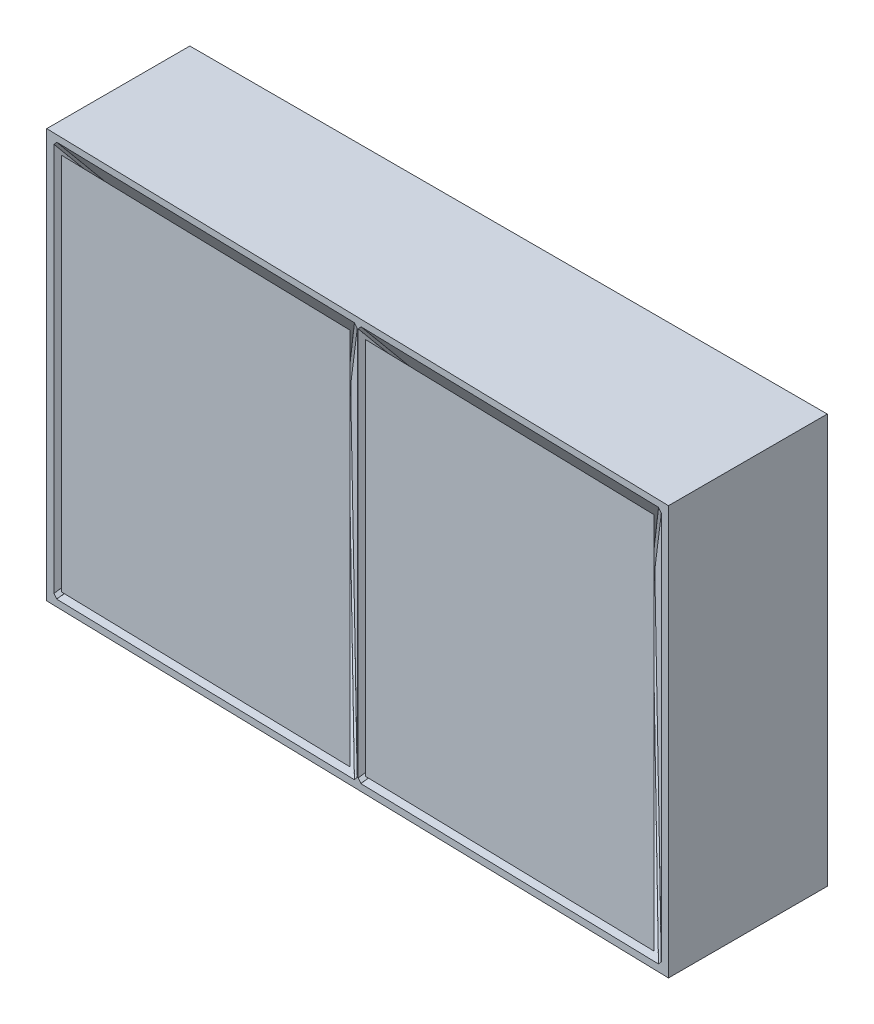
SolidWorks part; units mm, degrees
ref_plane "Ebene vorne" through (0, 0, 0) normal (0, 0, 1) x (1, 0, 0)
ref_plane "Ebene oben" through (0, 0, 0) normal (0, 1, 0) x (1, 0, 0)
ref_plane "Ebene rechts" through (0, 0, 0) normal (1, 0, 0) x (0, 0, -1)
sketch "Skizze1" plane through (0, 0, 0) normal (0, 0, 1) x (1, 0, 0)
  line L0 (1220.3266, 1032.8596) -> (1220.3266, -133.7284) construction
  line L1 (-639.9725, -153.7062) -> (1240.3266, -153.7062)
  line L2 (-639.9725, -153.7062) -> (-639.9725, 1052.8596)
  line L3 (-639.9725, 1052.8596) -> (1240.3266, 1052.8596)
  line L4 (1240.3266, -153.7062) -> (1240.3266, 1052.8596)
  line L5 (-619.48, 1032.8596) -> (1220.3266, 1032.8596) construction
  line L6 (-609.3986, -133.7062) -> (290.3285, -133.7062) construction
  line L7 (-619.9725, 1032.8596) -> (-619.9725, -133.7284) construction
  dimension "D1" = 20
  dimension "D2" = 20
  dimension "D3" = 20
  dimension "D4" = 20
extrude "Aufsatz-Linear austragen1" add sketch "Skizze1" along normal up to surface (422.0929 mm away)
other "Formnest3"
other "Unterbau_PU_Schaum<1>@3er-Wanne_3er-Wanne/Trichter_3er_Stripper<2>@Unterbau_PU_Schaum/Trichter_Schweißnaht<4>@Trichter_3er_Stripper"
other "Unterbau_PU_Schaum<1>@3er-Wanne_3er-Wanne/Trichter_3er_Stripper<2>@Unterbau_PU_Schaum/Trichter_Ablauf_3er<1>@Trichter_3er_Stripper"
other "Unterbau_PU_Schaum<1>@3er-Wanne_3er-Wanne/Trichter_3er_Stripper<2>@Unterbau_PU_Schaum/Trichter_Schweißnaht<3>@Trichter_3er_Stripper"
other "Unterbau_PU_Schaum<1>@3er-Wanne_3er-Wanne/Trichter_3er_Stripper<2>@Unterbau_PU_Schaum/Trichter_Seitenteil<5>@Trichter_3er_Stripper"
other "Unterbau_PU_Schaum<1>@3er-Wanne_3er-Wanne/Trichter_3er_Stripper<2>@Unterbau_PU_Schaum/Trichter_Schweißnaht<2>@Trichter_3er_Stripper"
other "Unterbau_PU_Schaum<1>@3er-Wanne_3er-Wanne/Trichter_3er_Stripper<2>@Unterbau_PU_Schaum/Trichter_Schweißnaht<1>@Trichter_3er_Stripper"
other "Unterbau_PU_Schaum<1>@3er-Wanne_3er-Wanne/Trichter_3er_Stripper<2>@Unterbau_PU_Schaum/Trichter_Seitenteil<3>@Trichter_3er_Stripper"
other "Unterbau_PU_Schaum<1>@3er-Wanne_3er-Wanne/Trichter_3er_Stripper<2>@Unterbau_PU_Schaum/Trichter_Seitenteil_breit<2>@Trichter_3er_Stripper"
other "Unterbau_PU_Schaum<1>@3er-Wanne_3er-Wanne/Trichter_3er_Stripper<2>@Unterbau_PU_Schaum/Trichter_Seitenteil_breit<1>@Trichter_3er_Stripper"
other "Unterbau_PU_Schaum<1>@3er-Wanne_3er-Wanne/Trichter_3er_Stripper<1>@Unterbau_PU_Schaum/Trichter_Ablauf_3er<1>@Trichter_3er_Stripper"
other "Unterbau_PU_Schaum<1>@3er-Wanne_3er-Wanne/Trichter_3er_Stripper<1>@Unterbau_PU_Schaum/Trichter_Schweißnaht<4>@Trichter_3er_Stripper"
other "Unterbau_PU_Schaum<1>@3er-Wanne_3er-Wanne/Trichter_3er_Stripper<1>@Unterbau_PU_Schaum/Trichter_Schweißnaht<3>@Trichter_3er_Stripper"
other "Unterbau_PU_Schaum<1>@3er-Wanne_3er-Wanne/Trichter_3er_Stripper<1>@Unterbau_PU_Schaum/Trichter_Schweißnaht<2>@Trichter_3er_Stripper"
other "Unterbau_PU_Schaum<1>@3er-Wanne_3er-Wanne/Trichter_3er_Stripper<1>@Unterbau_PU_Schaum/Trichter_Schweißnaht<1>@Trichter_3er_Stripper"
other "Unterbau_PU_Schaum<1>@3er-Wanne_3er-Wanne/Trichter_3er_Stripper<1>@Unterbau_PU_Schaum/Trichter_Seitenteil<5>@Trichter_3er_Stripper"
other "Unterbau_PU_Schaum<1>@3er-Wanne_3er-Wanne/Trichter_3er_Stripper<1>@Unterbau_PU_Schaum/Trichter_Seitenteil_breit<2>@Trichter_3er_Stripper"
other "Unterbau_PU_Schaum<1>@3er-Wanne_3er-Wanne/Trichter_3er_Stripper<1>@Unterbau_PU_Schaum/Trichter_Seitenteil<3>@Trichter_3er_Stripper"
other "Unterbau_PU_Schaum<1>@3er-Wanne_3er-Wanne/Trichter_3er_Stripper<1>@Unterbau_PU_Schaum/Trichter_Seitenteil_breit<1>@Trichter_3er_Stripper"
